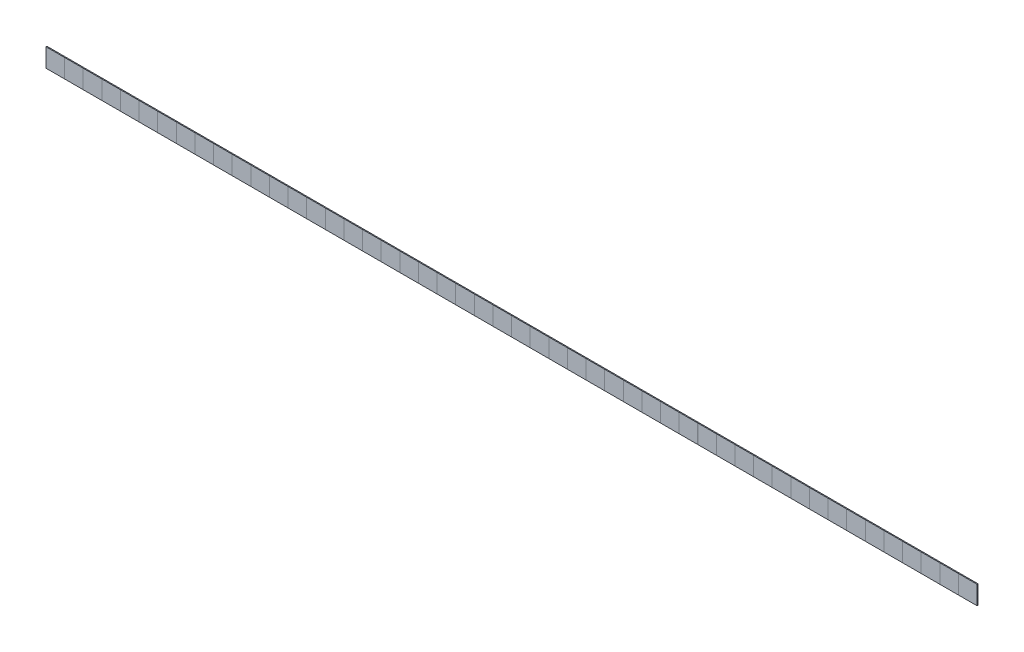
SolidWorks part; units mm, degrees
ref_plane "Plan de face" through (0, 0, 0) normal (0, 0, 1) x (1, 0, 0)
ref_plane "Plan de dessus" through (0, 0, 0) normal (0, 1, 0) x (1, 0, 0)
ref_plane "Plan de droite" through (0, 0, 0) normal (1, 0, 0) x (0, 0, -1)
sketch "Esquisse1" plane through (0, 0, 0) normal (0, 0, 1) x (1, 0, 0)
  line L1 (-16807.5789, 5518.2927) -> (483192.4211, 5518.2927)
  line L2 (-16807.5789, 5518.2927) -> (-16807.5789, -4481.7073)
  line L3 (-16807.5789, -4481.7073) -> (483192.4211, -4481.7073)
  line L4 (483192.4211, 5518.2927) -> (483192.4211, -4481.7073)
  line L5 (-16807.5789, 5518.2927) -> (483192.4211, -4481.7073) construction
  line L6 (-16807.5789, -4481.7073) -> (483192.4211, 5518.2927) construction
  point P0 (233192.4211, 518.2927)
  dimension "D1" = 10000
  dimension "D2" = 500000
extrude "Boss.-Extru.1" add sketch "Esquisse1" along normal blind 500
sketch "Esquisse5" plane through (0, -4481.7073, 0) normal (0, -1, 0) x (1, 0, 0)
  line L0 (-16807.5789, 500) -> (483192.4211, 500) construction
  circle A0 centre (-16807.5789, 500) radius 2.5
  dimension "D1" = 5
  dimension "D2" = 0
extrude "Enlèv. mat.-Extru.1" cut sketch "Esquisse5" against normal blind 32322
pattern_linear "Répétition linéaire1" count 1000 spacing 10000 along (1, 0, 0) of "Enlèv. mat.-Extru.1"
